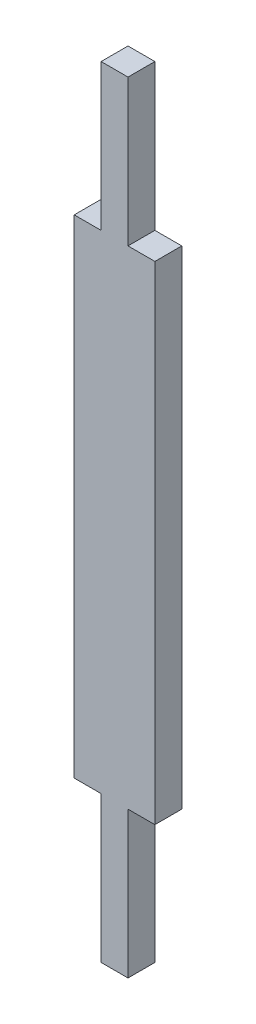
SolidWorks part; units mm, degrees
ref_plane "Front Plane" through (0, 0, 0) normal (0, 0, 1) x (1, 0, 0)
ref_plane "Top Plane" through (0, 0, 0) normal (0, 1, 0) x (1, 0, 0)
ref_plane "Right Plane" through (0, 0, 0) normal (1, 0, 0) x (0, 0, -1)
sketch "Sketch1" plane through (0, 0, 0) normal (0, 0, 1) x (1, 0, 0)
  line L0 (1.524, -22.0841) -> (0, -22.0841)
  line L1 (0, -22.0841) -> (0, 5.561)
  line L2 (0, 5.561) -> (1.524, 5.561)
  line L3 (1.524, 5.561) -> (1.524, 13.8484)
  line L4 (0, -8.2616) -> (-17.8617, -8.2616) construction
  line L5 (1.524, -22.0841) -> (1.524, -30.3715)
  line L6 (1.524, 13.8484) -> (3.048, 13.8484)
  line L7 (1.524, -30.3715) -> (3.048, -30.3715)
  line L8 (2.286, 13.8484) -> (2.286, 27.7526) construction
  line L9 (3.048, -22.0841) -> (3.048, -30.3715)
  line L10 (3.048, 5.561) -> (3.048, 13.8484)
  line L11 (4.572, 5.561) -> (3.048, 5.561)
  line L12 (4.572, -22.0841) -> (4.572, 5.561)
  line L13 (3.048, -22.0841) -> (4.572, -22.0841)
extrude "Boss-Extrude1" add sketch "Sketch1" along normal blind 1.524
